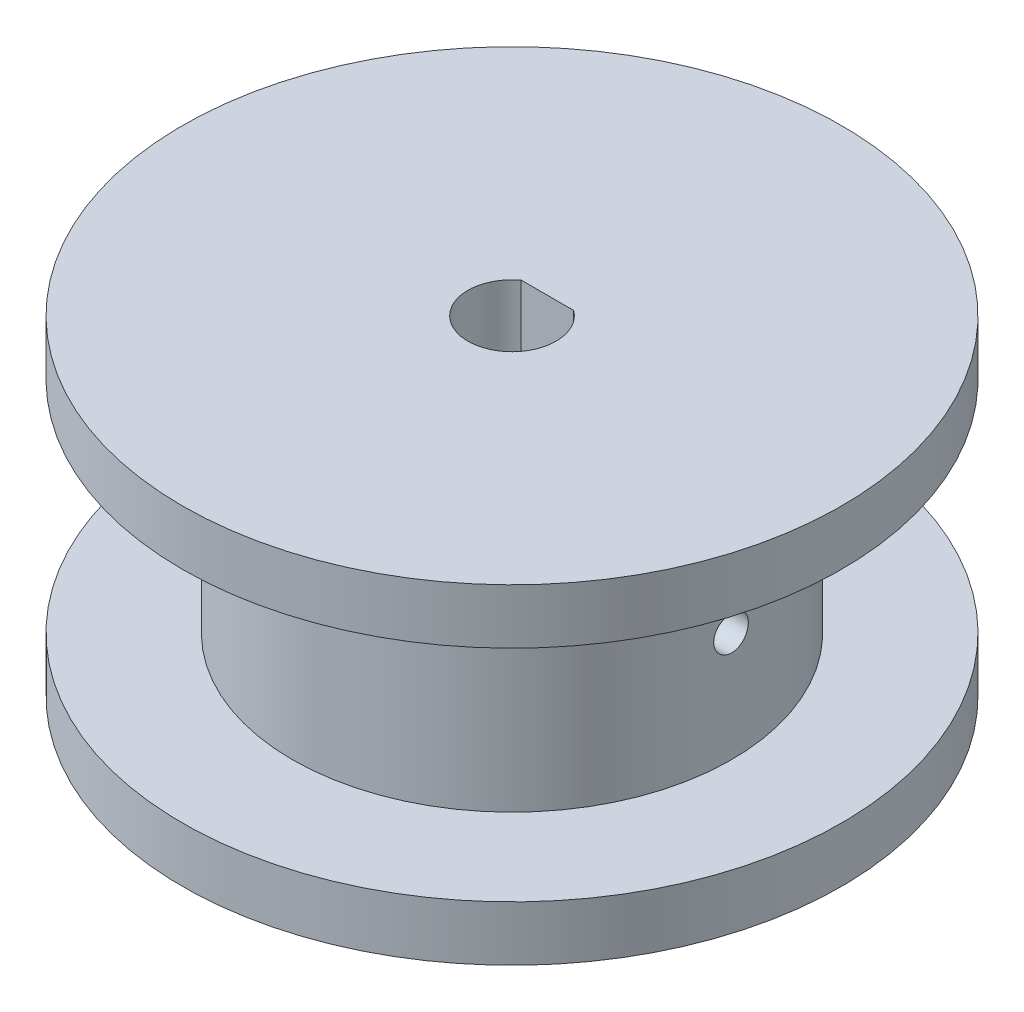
SolidWorks part; units mm, degrees
ref_plane "Front Plane" through (0, 0, 0) normal (0, 0, 1) x (1, 0, 0)
ref_plane "Top Plane" through (0, 0, 0) normal (0, 1, 0) x (1, 0, 0)
ref_plane "Right Plane" through (0, 0, 0) normal (1, 0, 0) x (0, 0, -1)
sketch "Sketch1" plane through (0, 0, 0) normal (0, 1, 0) x (1, 0, 0)
  line L0 (1.5, 2) -> (-1.5, 2) construction
  line L1 (1.5166, 2.05) -> (-1.5166, 2.05)
  arc A0 (-1.5, 2) -> (1.5, 2) centre (0, 0) ccw construction
  arc A1 (-1.5166, 2.05) -> (1.5166, 2.05) centre (0, 0) ccw
  circle A2 centre (0, 0) radius 12.7
  dimension "D2" = 25.4
  dimension "D1" = 0.05
extrude "Boss-Extrude1" add sketch "Sketch1" along normal blind 12.7
sketch "Sketch2" plane through (0, 0, 0) normal (0, -1, 0) x (1, 0, 0)
  line L0 (1.5166, -2.05) -> (-1.5166, -2.05) construction
  line L1 (1.5166, -2.05) -> (-1.5166, -2.05)
  arc A0 (1.5166, -2.05) -> (-1.5166, -2.05) centre (0, 0) ccw construction
  arc A1 (1.5166, -2.05) -> (-1.5166, -2.05) centre (0, 0) ccw
  circle A2 centre (0, 0) radius 19.05
  dimension "D1" = 38.1
extrude "Boss-Extrude2" add sketch "Sketch2" along normal blind 3.175
sketch "Sketch3" plane through (0, -3.175, 0) normal (0, -1, 0) x (1, 0, 0)
  line L0 (-1.5166, -2.05) -> (1.5166, -2.05) construction
  line L1 (-1.5166, -2.05) -> (1.5166, -2.05)
  arc A0 (1.5166, -2.05) -> (-1.5166, -2.05) centre (0, 0) ccw construction
  arc A1 (1.5166, -2.05) -> (-1.5166, -2.05) centre (0, 0) ccw
  circle A2 centre (0, 0) radius 5.725
  dimension "D1" = 3.175
extrude "Boss-Extrude3" add sketch "Sketch3" along normal blind 6.35
sketch "Sketch4" plane through (0, 0, -2.05) normal (0, 0, 1) x (1, 0, 0)
  line L0 (0, -9.525) -> (0, -3.175) construction
  line L1 (-5.725, -9.525) -> (5.725, -9.525) construction
  line L2 (-19.05, -3.175) -> (19.05, -3.175) construction
  circle A0 centre (0, -6.35) radius 1.375
  dimension "D1" = 2.75
extrude "Cut-Extrude1" cut sketch "Sketch4" against normal through all both and the other way through all
sketch "Sketch5" plane through (0, 12.7, 0) normal (0, 1, 0) x (1, 0, 0)
  line L0 (1.5166, 2.05) -> (-1.5166, 2.05) construction
  line L1 (1.5166, 2.05) -> (-1.5166, 2.05)
  arc A0 (-1.5166, 2.05) -> (1.5166, 2.05) centre (0, 0) ccw construction
  arc A1 (-1.5166, 2.05) -> (1.5166, 2.05) centre (0, 0) ccw
  circle A2 centre (0, 0) radius 19.05
  circle A3 centre (0, 0) radius 19.05 construction
extrude "Boss-Extrude4" add sketch "Sketch5" along normal blind 3.175
sketch "Sketch7" plane through (0, 0, 0) normal (1, 0, 0) x (0, 0, -1)
  line L0 (-12.7, 6.35) -> (0, 6.35) construction
  line L1 (-12.7, 12.7) -> (-12.7, 0) construction
  line L2 (0, 6.35) -> (12.7, 6.35) construction
  line L3 (12.7, 0) -> (12.7, 12.7) construction
  circle A0 centre (0, 6.35) radius 1
  dimension "D1" = 2
extrude "Cut-Extrude3" cut sketch "Sketch7" against normal through all both and the other way through all
